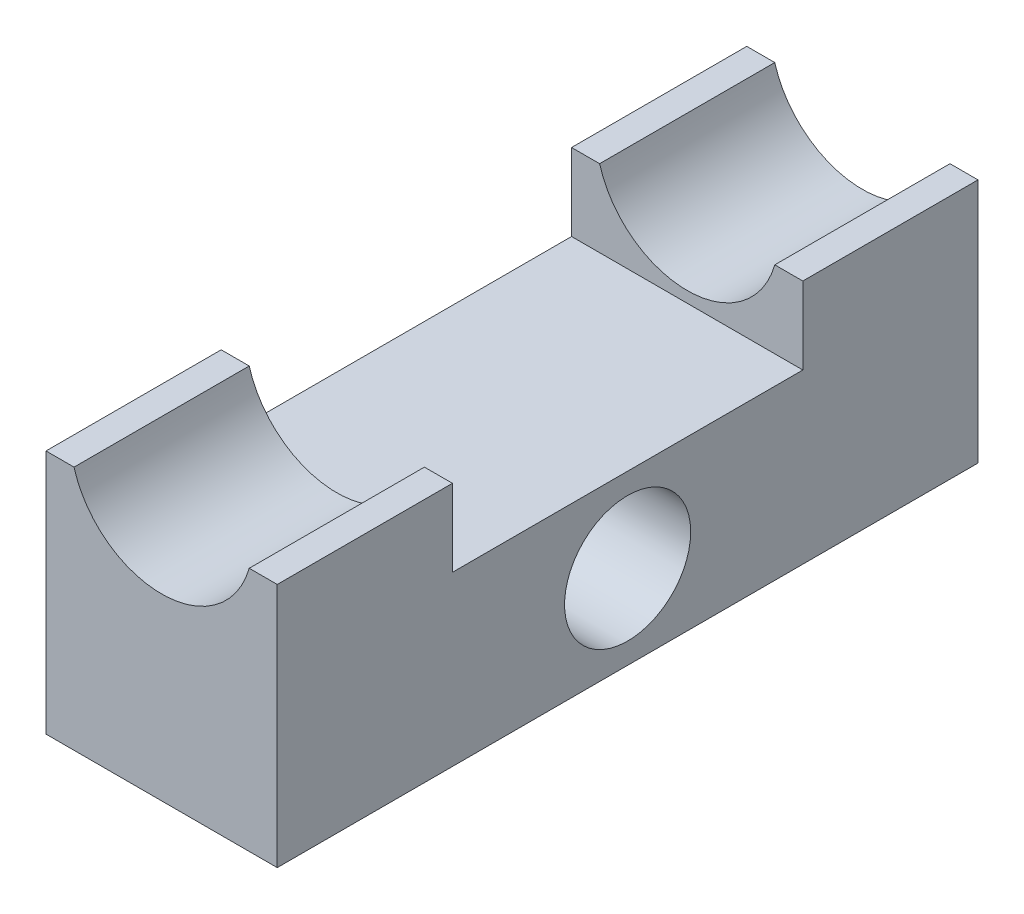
SolidWorks part; units mm, degrees
ref_plane "Plan de face" through (0, 0, 0) normal (0, 0, 1) x (1, 0, 0)
ref_plane "Plan de dessus" through (0, 0, 0) normal (0, 1, 0) x (1, 0, 0)
ref_plane "Plan de droite" through (0, 0, 0) normal (1, 0, 0) x (0, 0, -1)
sketch "Esquisse1" plane through (0, 0, 0) normal (0, 0, 1) x (1, 0, 0)
  line L1 (1007.5, 388.7285) -> (1003.5, 388.7285)
  line L2 (1003.5, 388.7285) -> (1003.5, 353.7285)
  line L3 (1003.5, 353.7285) -> (1036.5, 353.7285)
  line L4 (1036.5, 353.7285) -> (1036.5, 388.7285)
  line L5 (1036.5, 388.7285) -> (1032.5, 388.7285)
  arc A0 (1007.5, 388.7285) -> (1032.5, 388.7285) centre (1020, 392.2992) ccw
  point P0 (0, 0)
  point P3 (0, 0)
  dimension "D2" = 26
  dimension "D3" = 4
  dimension "D4" = 4
  dimension "D5" = 35
  dimension "D6" = 33
extrude "Boss.-Extru.1" add sketch "Esquisse1" along normal blind 100
sketch "Esquisse2" plane through (1036.5, 0, 0) normal (1, 0, 0) x (0, 0, -1)
  line L0 (-100, 353.7285) -> (-100, 388.7285) construction
  line L1 (-100, 388.7285) -> (0, 388.7285) construction
  line L2 (0, 353.7285) -> (0, 388.7285) construction
  line L3 (-75, 388.7285) -> (-25, 388.7285)
  line L4 (-75, 388.7285) -> (-75, 377.7285)
  line L5 (-75, 377.7285) -> (-25, 377.7285)
  line L6 (-25, 388.7285) -> (-25, 377.7285)
  circle A0 centre (-50, 365.7285) radius 9
  point P2 (-25, 383.2285)
  dimension "D1" = 18
  dimension "D2" = 50
  dimension "D3" = 23
  dimension "D4" = 25
  dimension "D5" = 25
  dimension "D6" = 11
extrude "Enlèv. mat.-Extru.1" cut sketch "Esquisse2" against normal blind 100
